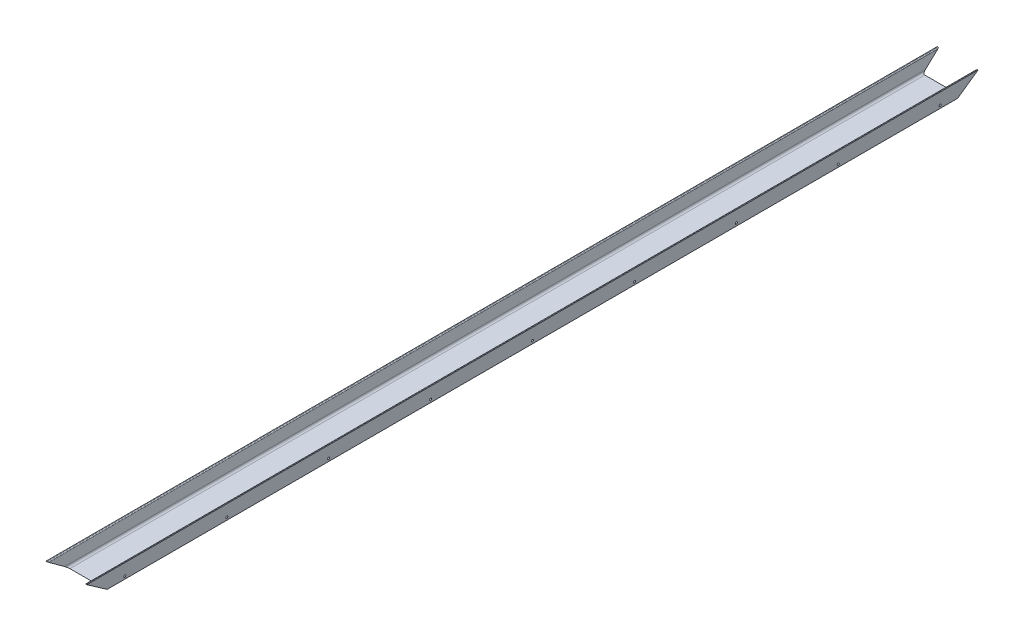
SolidWorks part; units mm, degrees
ref_plane "Front Plane" through (0, 0, 0) normal (0, 0, 1) x (1, 0, 0)
ref_plane "Top Plane" through (0, 0, 0) normal (0, 1, 0) x (1, 0, 0)
ref_plane "Right Plane" through (0, 0, 0) normal (1, 0, 0) x (0, 0, -1)
sketch3d "3DSketch1"
  line L0 (0, 0, -1388.364) -> (0, 0, 1388.364)
  dimension "D1" = 2776.728
other "Structural Member1"
ref_plane "Plane1" through (0, 0, -1388.364) normal (0, 0, 1) x (0, 1, 0)
sketch "Sketch1" plane through (0, 0, -1388.364) normal (0, 0, 1) x (0, 1, 0)
  line L0 (0, -63.5) -> (0, 63.5)
  line L1 (0, 63.5) -> (44.45, 63.5)
  line L2 (0, -63.5) -> (44.45, -63.5)
  line L6 (0, 0) -> (4.826, 0) construction
  line L12 (4.826, 45.8301) -> (4.826, -45.8301)
  line L15 (44.45, 63.5) -> (44.45, 61.0413)
  line L16 (44.45, -63.5) -> (44.45, -61.0413)
  line L17 (10.981, 53.0959) -> (42.1154, 58.2853)
  line L18 (10.981, -53.0959) -> (42.1154, -58.2853)
  arc A9 (4.826, -45.8301) -> (10.981, -53.0959) centre (12.192, -45.8301) ccw
  arc A10 (4.826, 45.8301) -> (10.981, 53.0959) centre (12.192, 45.8301) cw
  arc A11 (44.45, 61.0413) -> (42.1154, 58.2853) centre (41.656, 61.0413) cw
  arc A12 (44.45, -61.0413) -> (42.1154, -58.2853) centre (41.656, -61.0413) ccw
  point P4 (44.45, 58.6744)
  point P5 (44.45, -58.6744)
  point P6 (2.413, 0)
  point P7 (22.225, 63.5)
  point P8 (0, 0)
  point P12 (22.225, -63.5)
  dimension "RI" = 7.366
  dimension "D2" = 9.463
  dimension "RA" = 2.794
  dimension "Depth" = 127
  dimension "BF" = 44.45
  dimension "TW" = 4.826
  dimension "flange" = 2.4587
sketch "Sketch12" plane through (0, 0, 0) normal (1, 0, 0) x (0, 0, -1)
  line L0 (-1388.364, 44.45) -> (-1324.8828, 0)
  line L1 (1388.364, 0) -> (-1388.364, 0) construction
  line L2 (-1388.364, 44.45) -> (-1388.364, 0)
  line L3 (-1388.364, 0) -> (-1324.8828, 0)
  line L4 (0, 0) -> (0, 235.9944) construction
  line L5 (1388.364, 0) -> (1324.8828, 0)
  line L6 (1388.364, 44.45) -> (1388.364, 0)
  line L7 (1388.364, 44.45) -> (1324.8828, 0)
  dimension "D1" = 35
extrude "Cut-Extrude1" cut sketch "Sketch12" against normal through all both and the other way through all
hole_wizard "1/4 (0.25) Diameter Hole1" positions "Sketch14" profile "Sketch13" hole size "1/4" standard "ANSI Inch"
sketch "Sketch14" plane through (63.5, 0, 0) normal (1, 0, 0) x (0, 0, -1)
  line L0 (1388.364, 0) -> (-1388.364, 0) construction
  point P0 (-1269.5345, 8.382)
  dimension "D1" = 8.382
sketch "Sketch13" plane through (63.5, 8.382, 1269.5345) normal (0, 1, 0) x (0, 0, -1)
  line L0 (0, 0) -> (0, 25.4)
  line L1 (0, 25.4) -> (3.175, 25.4)
  line L2 (3.175, 25.4) -> (3.175, 0)
  line L5 (3.175, 0) -> (0, 0)
  line L10 (0, 25.4) -> (-3.175, 25.4) construction
  line L11 (0, -6.35) -> (0, 107.95) construction
  dimension "Hole Dia." = 6.35
  dimension "Hole Depth" = 25.4
  dimension "Drill Angle" = 180
pattern_linear "LPattern1" count 9 spacing 317.5 along (0, 0, -1) of "1/4 (0.25) Diameter Hole1"
